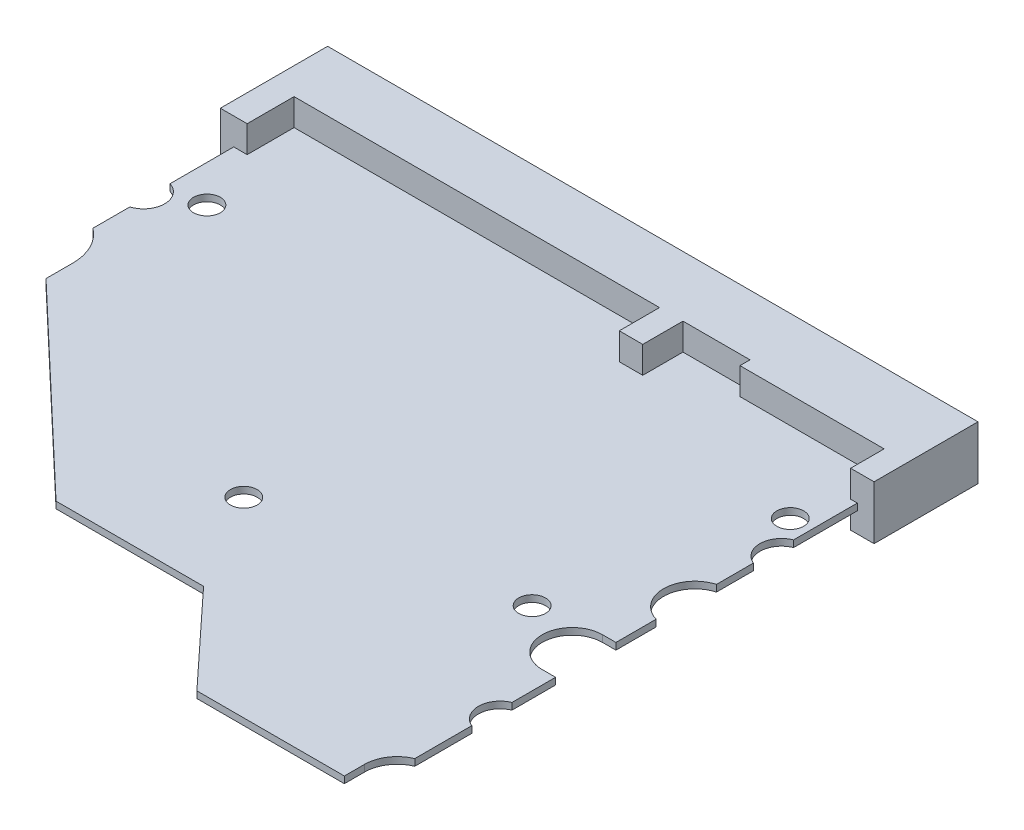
SolidWorks part; units mm, degrees
ref_plane "Front Plane" through (0, 0, 0) normal (0, 0, 1) x (1, 0, 0)
ref_plane "Top Plane" through (0, 0, 0) normal (0, 1, 0) x (1, 0, 0)
ref_plane "Right Plane" through (0, 0, 0) normal (1, 0, 0) x (0, 0, -1)
sketch "Sketch2" plane through (0, 0, 0) normal (0, 1, 0) x (1, 0, 0)
  line L1 (-48.5, -44.5) -> (48.5, -44.5)
  line L2 (-48.5, -44.5) -> (-48.5, 44.5)
  line L3 (-48.5, 44.5) -> (48.5, 44.5)
  line L4 (48.5, -44.5) -> (48.5, 44.5)
  line L5 (-48.5, -44.5) -> (48.5, 44.5) construction
  line L6 (-48.5, 44.5) -> (48.5, -44.5) construction
  point P0 (0, 0)
  dimension "D1" = 97
  dimension "D2" = 89
extrude "Boss-Extrude2" add sketch "Sketch2" along normal blind 8
sketch "Sketch3" plane through (0, 8, 0) normal (0, 1, 0) x (1, 0, 0)
  line L0 (-48.5, 44.5) -> (-48.5, -44.5) construction
  line L1 (48.5, 44.5) -> (-48.5, 44.5) construction
  line L2 (-48.5, 28.5) -> (-44.5, 28.5)
  line L3 (-44.5, 28.5) -> (-44.5, 35.5)
  line L4 (-44.5, 35.5) -> (10, 35.5)
  line L5 (10, 35.5) -> (10, 29.5)
  line L6 (10, 29.5) -> (13.5, 29.5)
  line L7 (13.5, 29.5) -> (13.5, 35.5)
  line L8 (13.5, 35.5) -> (23.5, 35.5)
  line L9 (23.5, 35.5) -> (23.5, 34)
  line L10 (23.5, 34) -> (45, 34)
  line L11 (45, 34) -> (45, 29)
  line L12 (45, 29) -> (48.5, 29)
  line L13 (48.5, -44.5) -> (48.5, 44.5) construction
  line L14 (48.5, 29) -> (48.5, -44.5)
  line L15 (48.5, -44.5) -> (-48.5, -44.5)
  line L16 (-48.5, -44.5) -> (-48.5, 28.5)
  point P0 (-48.5, 28.5)
  point P23 (0, 0)
  dimension "D1" = 16
  dimension "D2" = 4
  dimension "D3" = 7
  dimension "D4" = 54.5
  dimension "D5" = 6
  dimension "D6" = 3.5
  dimension "D7" = 10
  dimension "D8" = 6
  dimension "D9" = 1.5
  dimension "D10" = 21.5
  dimension "D11" = 3.5
  dimension "D12" = 5
extrude "Cut-Extrude1" cut sketch "Sketch3" against normal blind 4
sketch "Sketch4" plane through (0, 0, 0) normal (0, -1, 0) x (1, 0, 0)
  line L14 (48.5, 44.5) -> (48.5, -29)
  line L15 (48.5, 44.5) -> (48.5, -44.5) construction
  line L16 (48.5, -29) -> (45, -29)
  line L17 (45, -29) -> (45, -37)
  line L18 (45, -37) -> (13.5, -37)
  line L19 (13.5, -37) -> (13.5, -30)
  line L20 (13.5, -30) -> (10, -30)
  line L21 (10, -30) -> (10, -37)
  line L22 (10, -37) -> (-44.5, -37)
  line L23 (-44.5, -37) -> (-44.5, -28.5)
  line L24 (-44.5, -28.5) -> (-48.5, -28.5)
  line L25 (-48.5, -44.5) -> (-48.5, 44.5) construction
  line L26 (-48.5, -28.5) -> (-48.5, 44.5)
  line L27 (-48.5, 44.5) -> (48.5, 44.5)
  line L28 (48.5, -44.5) -> (-48.5, -44.5) construction
  dimension "D1" = 15.5
  dimension "D2" = 8
  dimension "D3" = 31.5
  dimension "D4" = 7
  dimension "D5" = 3.5
  dimension "D6" = 54.5
  dimension "D7" = 4
  dimension "D8" = 8.5
  dimension "D9" = 7
extrude "Cut-Extrude2" cut sketch "Sketch4" against normal blind 3
sketch "Sketch7" plane through (0, 3, 0) normal (0, -1, 0) x (1, 0, 0)
  line L0 (48.5, -29) -> (46, -29)
  line L1 (45, -29) -> (48.5, -29) construction
  line L2 (46, -29) -> (46, -19.5)
  line L3 (48.5, 44.5) -> (-48.5, 44.5) construction
  line L4 (46, 44.5) -> (48.5, 44.5)
  line L5 (48.5, 44.5) -> (48.5, -29)
  line L6 (46, -13.5) -> (46, -8)
  line L7 (46, 1) -> (46, 7)
  line L8 (46, 7) -> (44, 7)
  line L9 (46, 16) -> (44, 16)
  line L10 (46, 16) -> (46, 22.5)
  line L11 (46, 28.5) -> (46, 37)
  line L12 (43, 44.5) -> (43, 41.5)
  line L13 (43, 44.5) -> (46, 44.5)
  arc A0 (46, -19.5) -> (46, -13.5) centre (47.2095, -16.5) cw
  arc A1 (46, -8) -> (46, 1) centre (47.2878, -3.5) cw
  arc A2 (44, 7) -> (44, 16) centre (44, 11.5) cw
  arc A3 (46, 22.5) -> (46, 28.5) centre (47.2372, 25.5) cw
  arc A5 (43, 41.5) -> (46, 37) centre (47.875, 41.5) ccw
  point P5 (46, -16.5)
  point P11 (46, -19.5)
  point P12 (46, -13.5)
  point P13 (46, -3.5)
  point P17 (46, -8)
  point P18 (46, 1)
  point P19 (46, 11.5)
  point P20 (46, 7)
  point P24 (46, 16)
  point P30 (46, 25.5)
  point P31 (46, 22.5)
  point P32 (46, 28.5)
  point P33 (46, 37)
  point P34 (43, 44.5)
  dimension "D7" = 9
  dimension "D1" = 2.5
  dimension "D2" = 12.5
  dimension "D3" = 3
  dimension "D4" = 6
  dimension "D5" = 25.5
  dimension "D6" = 4.5
  dimension "D8" = 40.5
  dimension "D9" = 4.5
  dimension "D10" = 9
  dimension "D11" = 2
  dimension "D12" = 54.5
  dimension "D13" = 3
  dimension "D14" = 6
  dimension "D15" = 7.5
  dimension "D16" = 3
  dimension "D17" = 3
extrude "Cut-Extrude3" cut sketch "Sketch7" against normal blind 3.5
sketch "Sketch8" plane through (0, 3, 0) normal (0, -1, 0) x (1, 0, 0)
  line L0 (43, 44.5) -> (-48.5, 44.5) construction
  line L1 (46, 37) -> (46, 28.5) construction
  line L2 (-44.5, -37) -> (10, -37) construction
  line L3 (21, 44.5) -> (8, 30.5)
  line L4 (8, 30.5) -> (-14, 30.5)
  line L5 (46, 7) -> (46, 1) construction
  line L6 (-14, 30.5) -> (-43.5, 2.5)
  line L7 (-43.5, 2.5) -> (-43.5, -1.5)
  line L8 (-48.5, -28.5) -> (-44.5, -28.5) construction
  line L9 (-48.5, 44.5) -> (-48.5, -28.5) construction
  line L10 (-46.5, -7.5) -> (-46.5, -13)
  line L13 (-48.5, -28.5) -> (-44.5, -28.5) construction
  line L14 (-46.5, -19) -> (-46.5, -28.5)
  line L15 (-46.5, -28.5) -> (-48.5, -28.5)
  line L16 (-48.5, -28.5) -> (-48.5, 44.5)
  line L17 (-48.5, 44.5) -> (21, 44.5)
  arc A0 (-43.5, -1.5) -> (-46.5, -7.5) centre (-51, -1.5) cw
  arc A1 (-46.5, -19) -> (-46.5, -13) centre (-47.4465, -16) ccw
  point P0 (21, 44.5)
  point P1 (8, 30.5)
  point P9 (-43.5, 2.5)
  point P13 (-43.5, 2.5)
  point P16 (-46.5, -7.5)
  point P25 (-46.5, -16)
  point P29 (-46.5, -19)
  point P30 (-46.5, -13)
  dimension "D1" = 22
  dimension "D2" = 38
  dimension "D3" = 67.5
  dimension "D4" = 22
  dimension "D5" = 39.5
  dimension "D6" = 89.5
  dimension "D7" = 4
  dimension "D8" = 21
  dimension "D9" = 2
  dimension "D10" = 12.5
  dimension "D11" = 3
  dimension "D12" = 6
extrude "Cut-Extrude4" cut sketch "Sketch8" against normal blind 3.5
sketch "Sketch9" plane through (0, 3, 0) normal (0, -1, 0) x (1, 0, 0)
  line L0 (46, -19.5) -> (46, -29) construction
  line L1 (13.5, -37) -> (45, -37) construction
  line L2 (46, 7) -> (46, 1) construction
  line L3 (46, 22.5) -> (46, 16) construction
  line L4 (-14, 30.5) -> (8, 30.5) construction
  line L5 (-46.5, -28.5) -> (-46.5, -19) construction
  line L6 (-44.5, -37) -> (10, -37) construction
  circle A0 centre (43, -22) radius 2
  circle A1 centre (35, 8.5) radius 2
  circle A2 centre (-0.5, 16) radius 2
  circle A3 centre (-41, -19) radius 2
  point P0 (43, -22)
  point P1 (35, 8.5)
  point P2 (-0.5, 16)
  point P3 (-41, -19)
  point P12 (0, 0)
  point P23 (-54.2043, 35.7391)
  dimension "D1" = 4
  dimension "D2" = 4
  dimension "D3" = 4
  dimension "D4" = 4
  dimension "D5" = 3
  dimension "D6" = 15
  dimension "D7" = 11
  dimension "D8" = 45.5
  dimension "D9" = 46.5
  dimension "D10" = 14.5
  dimension "D11" = 5.5
  dimension "D12" = 18
extrude "Cut-Extrude5" cut sketch "Sketch9" against normal blind 3.5
